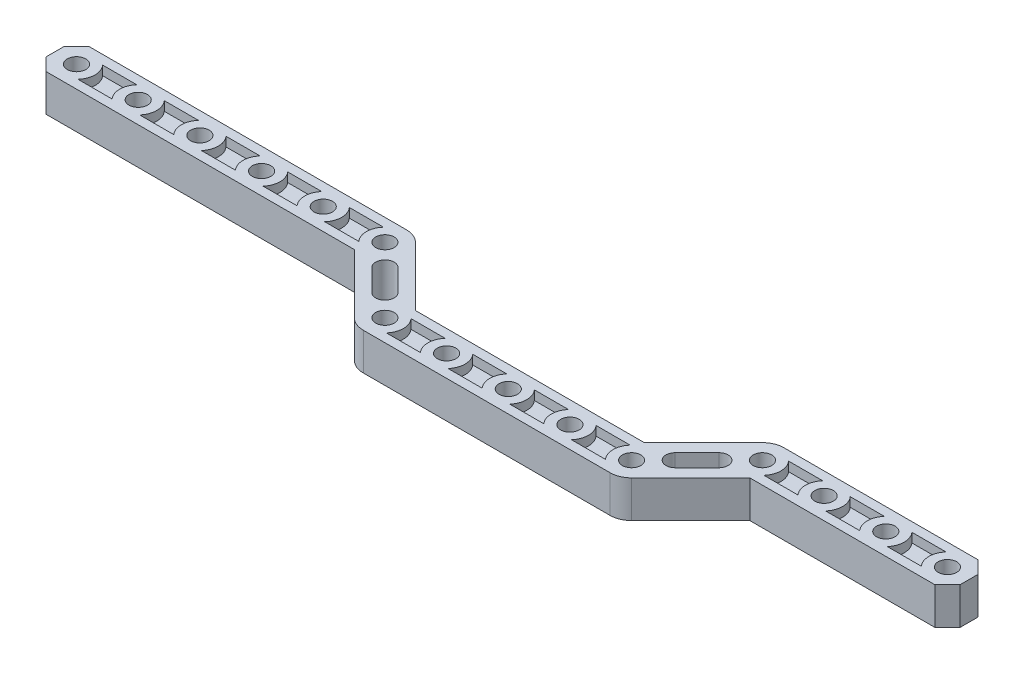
SolidWorks part; units mm, degrees
ref_plane "Front" through (0, 0, 0) normal (0, 0, 1) x (1, 0, 0)
ref_plane "Top" through (0, 0, 0) normal (0, 1, 0) x (1, 0, 0)
ref_plane "Right" through (0, 0, 0) normal (1, 0, 0) x (0, 0, -1)
sketch "Esquisse1" plane through (0, 0, 0) normal (0, 1, 0) x (1, 0, 0)
  line L0 (0, 0) -> (50, 0)
  line L1 (50, 0) -> (60.6066, -10.6066)
  line L2 (60.6066, -10.6066) -> (100.6066, -10.6066)
  line L5 (53.5355, -3.5355) -> (57.0711, -7.0711) construction
  line L12 (54.5962, -2.4749) -> (58.1317, -6.0104)
  line L13 (52.4749, -4.5962) -> (56.0104, -8.1317)
  line L14 (80.6066, -10.6066) -> (80.6066, 11.318) construction
  line L15 (107.6777, -3.5355) -> (104.1421, -7.0711) construction
  line L16 (106.617, -2.4749) -> (103.0815, -6.0104)
  line L17 (108.7383, -4.5962) -> (105.2028, -8.1317)
  line L23 (1.4497, 3.5) -> (-1.4497, 3.5)
  line L24 (-1.4497, 3.5) -> (-3.5, 1.4497)
  line L25 (-3.5, 1.4497) -> (-3.5, -1.4497)
  line L26 (-3.5, -1.4497) -> (-1.4497, -3.5)
  line L27 (-1.4497, -3.5) -> (1.4497, -3.5)
  line L28 (1.4497, -3.5) -> (3.5, -1.4497)
  line L29 (3.5, -1.4497) -> (3.5, 1.4497)
  line L30 (3.5, 1.4497) -> (1.4497, 3.5)
  line L31 (144.7132, 1.4497) -> (142.663, 3.5)
  line L32 (142.663, 3.5) -> (139.7635, 3.5)
  line L33 (139.7635, 3.5) -> (137.7132, 1.4497)
  line L34 (137.7132, 1.4497) -> (137.7132, -1.4497)
  line L35 (137.7132, -1.4497) -> (139.7635, -3.5)
  line L36 (139.7635, -3.5) -> (142.663, -3.5)
  line L37 (142.663, -3.5) -> (144.7132, -1.4497)
  line L38 (144.7132, -1.4497) -> (144.7132, 1.4497)
  circle A0 centre (0, 0) radius 1.5
  circle A2 centre (0, 0) radius 3.5 construction
  circle A3 centre (10, 0) radius 1.5
  circle A4 centre (20, 0) radius 1.5
  circle A5 centre (30, 0) radius 1.5
  circle A6 centre (40, 0) radius 1.5
  circle A7 centre (50, 0) radius 1.5
  arc A9 (54.5962, -2.4749) -> (52.4749, -4.5962) centre (53.5355, -3.5355) ccw
  arc A10 (56.0104, -8.1317) -> (58.1317, -6.0104) centre (57.0711, -7.0711) ccw
  circle A11 centre (60.6066, -10.6066) radius 1.5
  circle A12 centre (70.6066, -10.6066) radius 1.5
  circle A13 centre (80.6066, -10.6066) radius 1.5
  circle A14 centre (90.6066, -10.6066) radius 1.5
  circle A15 centre (100.6066, -10.6066) radius 1.5
  circle A16 centre (141.2132, 0) radius 1.5
  circle A17 centre (131.2132, 0) radius 1.5
  circle A18 centre (121.2132, 0) radius 1.5
  arc A19 (106.617, -2.4749) -> (108.7383, -4.5962) centre (107.6777, -3.5355) cw
  arc A20 (105.2028, -8.1317) -> (103.0815, -6.0104) centre (104.1421, -7.0711) cw
  circle A21 centre (111.2132, 0) radius 1.5
  circle A22 centre (50, 0) radius 3.5
  circle A23 centre (0, 0) radius 3.5
  circle A24 centre (141.2132, 0) radius 3.5 construction
  circle A25 centre (60.6066, -10.6066) radius 3.5
  circle A26 centre (111.2132, 0) radius 3.5
  circle A27 centre (100.6066, -10.6066) radius 3.5
  point P9 (55.3033, -5.3033)
  point P48 (105.9099, -5.3033)
  dimension "D2" = 3
  dimension "D3" = 7
  dimension "D1" = 135
  dimension "D5" = 10
  dimension "D6" = 5
  dimension "D7" = 10
  dimension "D8" = 10
  dimension "D10" = 10
  dimension "D4" = 6
  dimension "D9" = 5
sketch "Esquisse2" plane through (0, 0, 0) normal (0, 1, 0) x (1, 0, 0)
  line L6 (-1.4497, 3.5) -> (50, 3.5)
  line L7 (52.4749, 2.4749) -> (62.0563, -7.1066)
  line L8 (62.0563, -7.1066) -> (99.1569, -7.1066)
  line L9 (60.6066, -14.1066) -> (100.6066, -14.1066)
  line L10 (48.5503, -3.5) -> (58.1317, -13.0815)
  line L11 (-1.4497, -3.5) -> (48.5503, -3.5)
  line L12 (80.6066, -10.6066) -> (80.6066, 11.318) construction
  line L13 (80.6066, -10.6066) -> (80.6066, 11.318) construction
  line L14 (112.663, -3.5) -> (103.0815, -13.0815)
  line L15 (142.663, -3.5) -> (112.663, -3.5)
  line L16 (142.663, 3.5) -> (111.2132, 3.5)
  line L17 (108.7383, 2.4749) -> (99.1569, -7.1066)
  line L24 (52.4749, -4.5962) -> (56.0104, -8.1317) construction
  line L25 (54.5962, -2.4749) -> (58.1317, -6.0104) construction
  line L26 (52.4749, -4.5962) -> (56.0104, -8.1317)
  line L27 (54.5962, -2.4749) -> (58.1317, -6.0104)
  line L28 (106.617, -2.4749) -> (103.0815, -6.0104) construction
  line L29 (108.7383, -4.5962) -> (105.2028, -8.1317) construction
  line L30 (106.617, -2.4749) -> (103.0815, -6.0104)
  line L31 (108.7383, -4.5962) -> (105.2028, -8.1317)
  line L32 (-1.4497, 3.5) -> (-3.5, 1.4497) construction
  line L33 (-3.5, 1.4497) -> (-3.5, -1.4497) construction
  line L34 (-3.5, -1.4497) -> (-1.4497, -3.5) construction
  line L35 (-1.4497, 3.5) -> (-3.5, 1.4497)
  line L36 (-3.5, 1.4497) -> (-3.5, -1.4497)
  line L37 (-3.5, -1.4497) -> (-1.4497, -3.5)
  line L38 (144.7132, 1.4497) -> (142.663, 3.5) construction
  line L39 (144.7132, -1.4497) -> (144.7132, 1.4497) construction
  line L40 (142.663, -3.5) -> (144.7132, -1.4497) construction
  line L41 (144.7132, 1.4497) -> (142.663, 3.5)
  line L42 (144.7132, -1.4497) -> (144.7132, 1.4497)
  line L43 (142.663, -3.5) -> (144.7132, -1.4497)
  circle A0 centre (0, 0) radius 1.5 construction
  circle A1 centre (0, 0) radius 1.5
  circle A2 centre (10, 0) radius 1.5 construction
  circle A3 centre (10, 0) radius 1.5
  circle A4 centre (20, 0) radius 1.5 construction
  circle A5 centre (20, 0) radius 1.5
  circle A6 centre (30, 0) radius 1.5 construction
  circle A7 centre (30, 0) radius 1.5
  circle A8 centre (40, 0) radius 1.5 construction
  circle A9 centre (40, 0) radius 1.5
  circle A10 centre (50, 0) radius 1.5 construction
  circle A11 centre (50, 0) radius 1.5
  circle A12 centre (50, 0) radius 3.5 construction
  arc A13 (52.4749, 2.4749) -> (50, 3.5) centre (50, 0) ccw
  circle A14 centre (60.6066, -10.6066) radius 3.5 construction
  circle A15 centre (100.6066, -10.6066) radius 3.5 construction
  arc A16 (100.6066, -14.1066) -> (103.0815, -13.0815) centre (100.6066, -10.6066) ccw
  arc A17 (58.1317, -13.0815) -> (60.6066, -14.1066) centre (60.6066, -10.6066) ccw
  arc A18 (108.7383, 2.4749) -> (111.2132, 3.5) centre (111.2132, 0) cw
  arc A19 (54.5962, -2.4749) -> (52.4749, -4.5962) centre (53.5355, -3.5355) ccw construction
  arc A20 (56.0104, -8.1317) -> (58.1317, -6.0104) centre (57.0711, -7.0711) ccw construction
  arc A21 (54.5962, -2.4749) -> (52.4749, -4.5962) centre (53.5355, -3.5355) ccw
  arc A22 (56.0104, -8.1317) -> (58.1317, -6.0104) centre (57.0711, -7.0711) ccw
  circle A23 centre (60.6066, -10.6066) radius 1.5 construction
  circle A24 centre (60.6066, -10.6066) radius 1.5
  circle A25 centre (70.6066, -10.6066) radius 1.5 construction
  circle A26 centre (70.6066, -10.6066) radius 1.5
  circle A27 centre (80.6066, -10.6066) radius 1.5 construction
  circle A28 centre (80.6066, -10.6066) radius 1.5
  circle A29 centre (90.6066, -10.6066) radius 1.5 construction
  circle A30 centre (90.6066, -10.6066) radius 1.5
  circle A31 centre (100.6066, -10.6066) radius 1.5 construction
  circle A32 centre (100.6066, -10.6066) radius 1.5
  arc A33 (108.7383, -4.5962) -> (106.617, -2.4749) centre (107.6777, -3.5355) ccw construction
  arc A34 (103.0815, -6.0104) -> (105.2028, -8.1317) centre (104.1421, -7.0711) ccw construction
  arc A35 (108.7383, -4.5962) -> (106.617, -2.4749) centre (107.6777, -3.5355) ccw
  arc A36 (103.0815, -6.0104) -> (105.2028, -8.1317) centre (104.1421, -7.0711) ccw
  circle A37 centre (111.2132, 0) radius 1.5 construction
  circle A38 centre (111.2132, 0) radius 1.5
  circle A39 centre (121.2132, 0) radius 1.5 construction
  circle A40 centre (121.2132, 0) radius 1.5
  circle A41 centre (131.2132, 0) radius 1.5 construction
  circle A42 centre (131.2132, 0) radius 1.5
  circle A43 centre (141.2132, 0) radius 1.5 construction
  circle A44 centre (141.2132, 0) radius 1.5
extrude "Boss.-Extru.1" add sketch "Esquisse2" along normal blind 3
shell "Coque2" thickness 1.5
other "SupprimerFace1"
mirror "Symétrie1" about plane through (0, 0, 0) normal (0, 1, 0)
